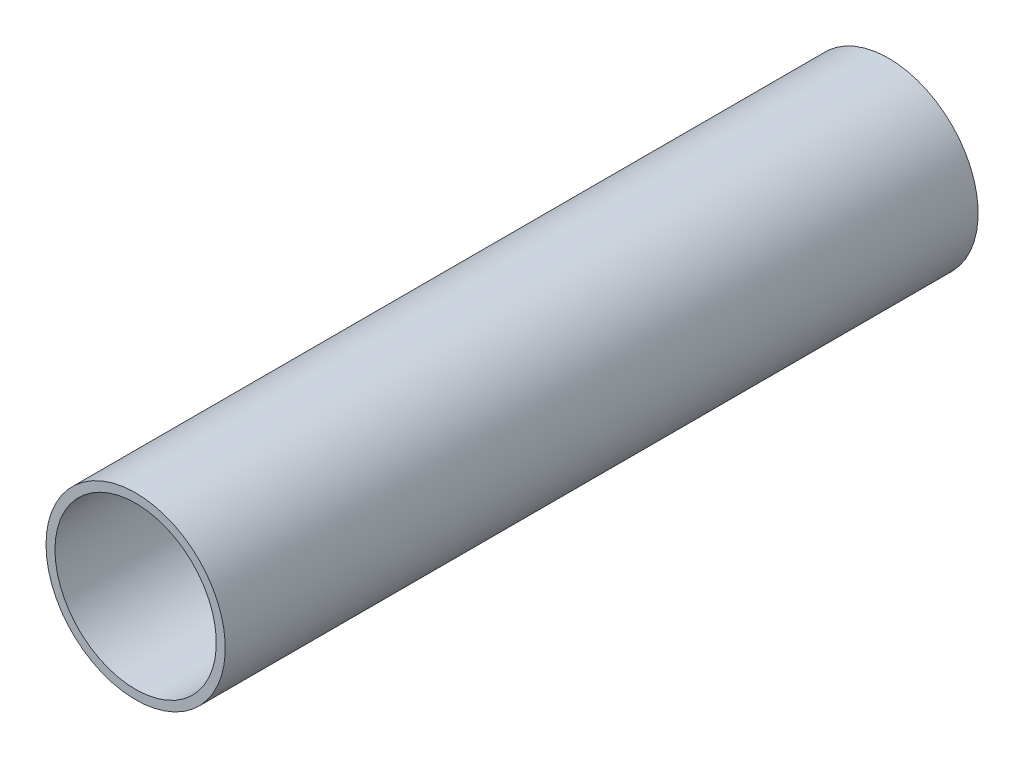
SolidWorks part; units mm, degrees
ref_plane "Plan de face" through (0, 0, 0) normal (0, 0, 1) x (1, 0, 0)
ref_plane "Plan de dessus" through (0, 0, 0) normal (0, 1, 0) x (1, 0, 0)
ref_plane "Plan de droite" through (0, 0, 0) normal (1, 0, 0) x (0, 0, -1)
sketch "Esquisse1" plane through (0, 0, 0) normal (0, 0, 1) x (1, 0, 0)
  circle A0 centre (0, 0) radius 10
  circle A1 centre (0, 0) radius 9
extrude "Boss.-Extru.1" add sketch "Esquisse1" along normal blind 84
